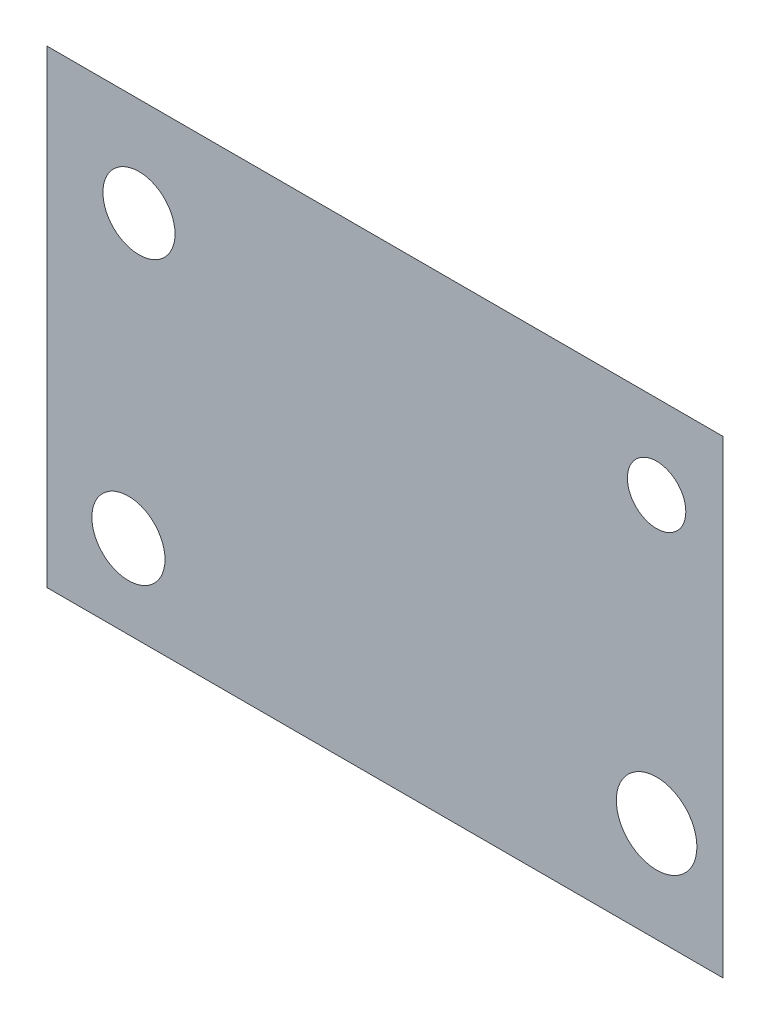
SolidWorks part; units mm, degrees
ref_plane "Plan de face" through (0, 0, 0) normal (0, 0, 1) x (1, 0, 0)
ref_plane "Plan de dessus" through (0, 0, 0) normal (0, 1, 0) x (1, 0, 0)
ref_plane "Plan de droite" through (0, 0, 0) normal (1, 0, 0) x (0, 0, -1)
sketch "Esquisse1" plane through (0, 0, 0) normal (0, 0, 1) x (1, 0, 0)
  line L1 (-41.7427, 32.8255) -> (-15.9925, 32.8255)
  line L2 (-41.7427, 32.8255) -> (-41.7427, -35.0225)
  line L3 (-41.7427, -35.0225) -> (-15.9925, -35.0225)
  line L5 (-15.9925, 32.8255) -> (31.9851, 32.8255)
  line L7 (-15.9925, -35.0225) -> (31.9851, -35.0225)
  line L9 (31.9851, 32.8255) -> (56.0851, 32.8255)
  line L11 (31.9851, -35.0225) -> (56.0851, -35.0225)
  line L12 (56.0851, 32.8255) -> (56.0851, -35.0225)
  circle A0 centre (-29.9446, -22.9589) radius 5.292
  circle A1 centre (-28.4203, 18.5451) radius 5.2166
  circle A2 centre (46.4624, 20.6894) radius 4.2261
  circle A3 centre (46.4624, -20.4867) radius 5.8274
surface "Surface-Plan1" sketch "Esquisse1"
